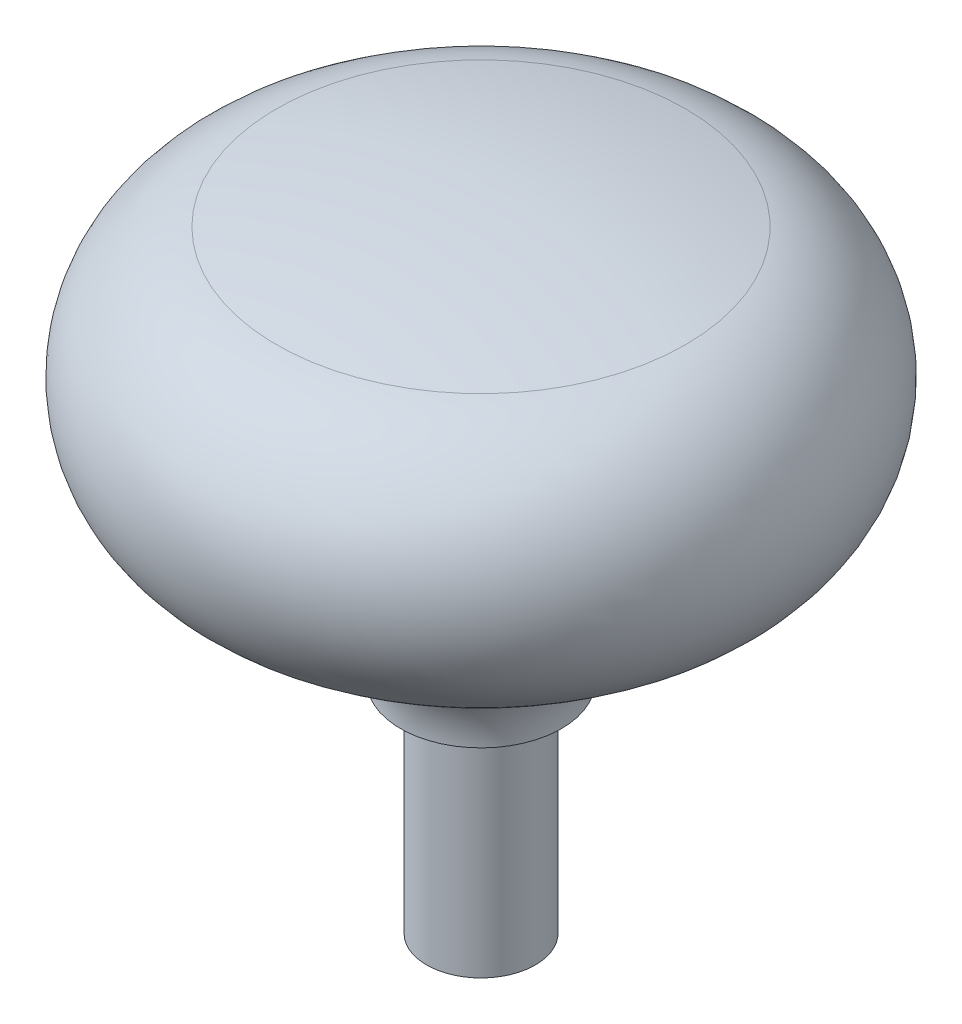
SolidWorks part; units mm, degrees
ref_plane "Front Plane" through (0, 0, 0) normal (0, 0, 1) x (1, 0, 0)
ref_plane "Top Plane" through (0, 0, 0) normal (0, 1, 0) x (1, 0, 0)
ref_plane "Right Plane" through (0, 0, 0) normal (1, 0, 0) x (0, 0, -1)
sketch "Sketch1" plane through (0, 0, 0) normal (0, 0, 1) x (1, 0, 0)
  line L0 (0, 37.0672) -> (0, 29.0752)
  line L1 (0, 29.0752) -> (27.9212, 29.0752)
  line L2 (0, 37.0672) -> (0, 29.0752) construction
  arc A0 (27.9212, 29.0752) -> (0, 37.0672) centre (0, -15.7025) ccw
revolve "Revolve1" add sketch "Sketch1" angle 360 about L2
sketch "Sketch2" plane through (0, 29.0752, 0) normal (0, -1, 0) x (1, 0, 0)
  circle A0 centre (0, 0) radius 27.9212
extrude "Extrude1" add sketch "Sketch2" along normal blind 12.9116 draft 60.926
sketch "Sketch3" plane through (0, 16.1636, 0) normal (0, -1, 0) x (1, 0, 0)
  circle A0 centre (0, 0) radius 4.699
extrude "Extrude2" add sketch "Sketch3" along normal blind 3.4636
fillet "Fillet1" radius 5.8888 1 edges at (0, 16.1636, -4.699)
fillet "Fillet2" radius 7.789 1 edges at (0, 29.0752, -27.9212)
sketch "Sketch4" plane through (0, 12.7, 0) normal (0, -1, 0) x (1, 0, 0)
  circle A0 centre (0, 0) radius 3.175
extrude "Extrude3" add sketch "Sketch4" along normal blind 12.7
